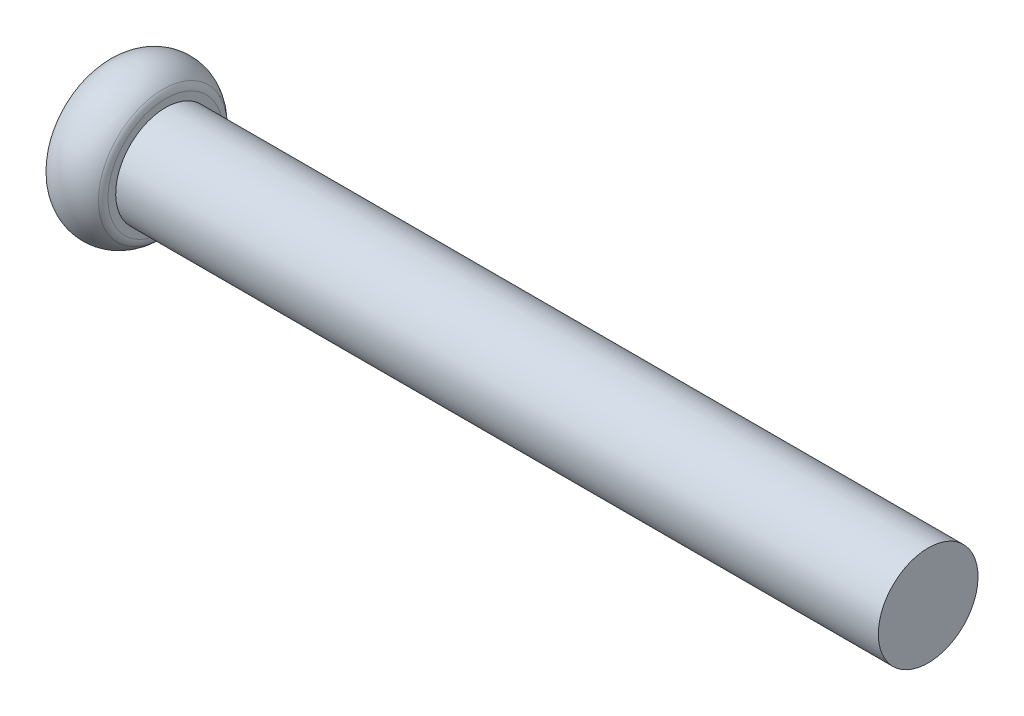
SolidWorks part; units mm, degrees
ref_plane "Front Plane" through (0, 0, 0) normal (0, 0, 1) x (1, 0, 0)
ref_plane "Top Plane" through (0, 0, 0) normal (0, 1, 0) x (1, 0, 0)
ref_plane "Right Plane" through (0, 0, 0) normal (1, 0, 0) x (0, 0, -1)
sketch "Sketch1" plane through (0, 0, 0) normal (0, 0, 1) x (1, 0, 0)
  line L0 (22.1448, 0) -> (-4.1395, 0) construction
  line L1 (1.3019, 1) -> (16.6, 1)
  line L2 (16.6, 1) -> (16.6, 0)
  line L3 (0, 0) -> (0, 0.7935)
  line L5 (16.6, 0) -> (0, 0)
  line L6 (1.3019, 1) -> (1.3019, 1.2266)
  arc A0 (0.1132, 1.1846) -> (0, 0.7935) centre (0.7322, 0.7935) ccw
  arc A1 (0.1132, 1.1846) -> (1.3019, 1.2266) centre (0.7219, 0.8) cw
  dimension "D6" = 0.7322
  dimension "D7" = 0.72
  dimension "D1" = 16.6
  dimension "D2" = 1
  dimension "D3" = 15.2981
  dimension "D4" = 0.7935
  dimension "D5" = 0.2266
revolve "Revolve1" add sketch "Sketch1" angle 360 about L0
sketch "Sketch2" plane through (0, 0, 0) normal (-1, 0, 0) x (0, 0, 1)
  line L0 (-0.3, -1.175) -> (0.3, -1.175)
  line L1 (-0.3, -1.175) -> (-0.3, 1.175)
  line L2 (0.3, 1.175) -> (-0.3, 1.175)
  line L3 (0.3, 1.175) -> (0.3, -1.175)
  line L4 (0.3, 0) -> (-0.3, 0) construction
  dimension "D1" = 2.35
  dimension "D2" = 0.6
sketch "Sketch3" plane through (1.3019, 0, 0) normal (1, 0, 0) x (0, 0, -1)
  line L0 (0.35, -0.442) -> (-0.35, -0.442)
  line L1 (0.35, -0.442) -> (0.35, 0.442)
  line L2 (-0.35, 0.442) -> (0.35, 0.442)
  line L3 (-0.35, 0.442) -> (-0.35, -0.442)
  line L6 (0.35, 0) -> (-0.35, 0) construction
  dimension "D1" = 0.884
  dimension "D2" = 0.7
loft "Cut-Loft1" cut profiles "Sketch2", "Sketch3"
pattern_circular "CirPattern1" count 2 over 90 about axis through (0, 0, 0) along (1, 0, 0) of "Cut-Loft1"
fillet "Fillet1" radius 0.2 1 edges at (1.3019, 1.2266, 0)
